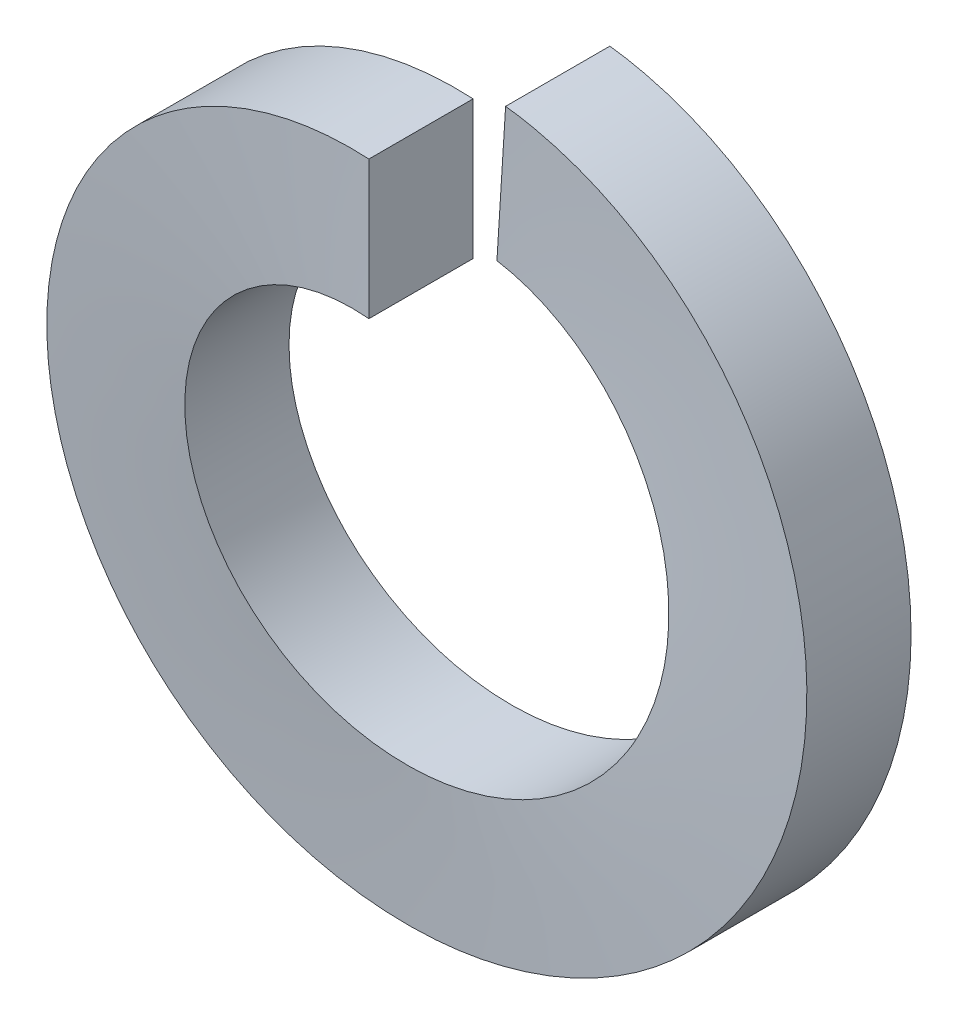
SolidWorks part; units mm, degrees
ref_plane "Front Plane" through (0, 0, 0) normal (0, 0, 1) x (1, 0, 0)
ref_plane "Top Plane" through (0, 0, 0) normal (0, 1, 0) x (1, 0, 0)
ref_plane "Right Plane" through (0, 0, 0) normal (1, 0, 0) x (0, 0, -1)
sketch "Sketch1" plane through (0, 0, 0) normal (0, 0, 1) x (1, 0, 0)
  line L0 (0, 16.0655) -> (0, 9.7282) construction
  circle A0 centre (0, 0) radius 16.0655
  circle A1 centre (0, 0) radius 9.7282 construction
  dimension "ID" = 19.4564
  dimension "OD" = 32.131
curve "Helix/Spiral1" parameters "HT"=5.2527
sketch "Sketch2" plane through (0, 0, 0) normal (1, 0, 0) x (0, 0, -1)
  line L1 (0, 16.0655) -> (-4.7752, 16.0655)
  line L2 (0, 16.0655) -> (0, 9.7282)
  line L3 (0, 9.7282) -> (-4.7752, 9.7282)
  line L4 (-4.7752, 16.0655) -> (-4.7752, 9.7282)
sweep "Sweep1" add profiles "Sketch2" path "Helix/Spiral1"
equation "\"HT@Helix/Spiral1\" = \"THK@Sketch2\"*1.1"
